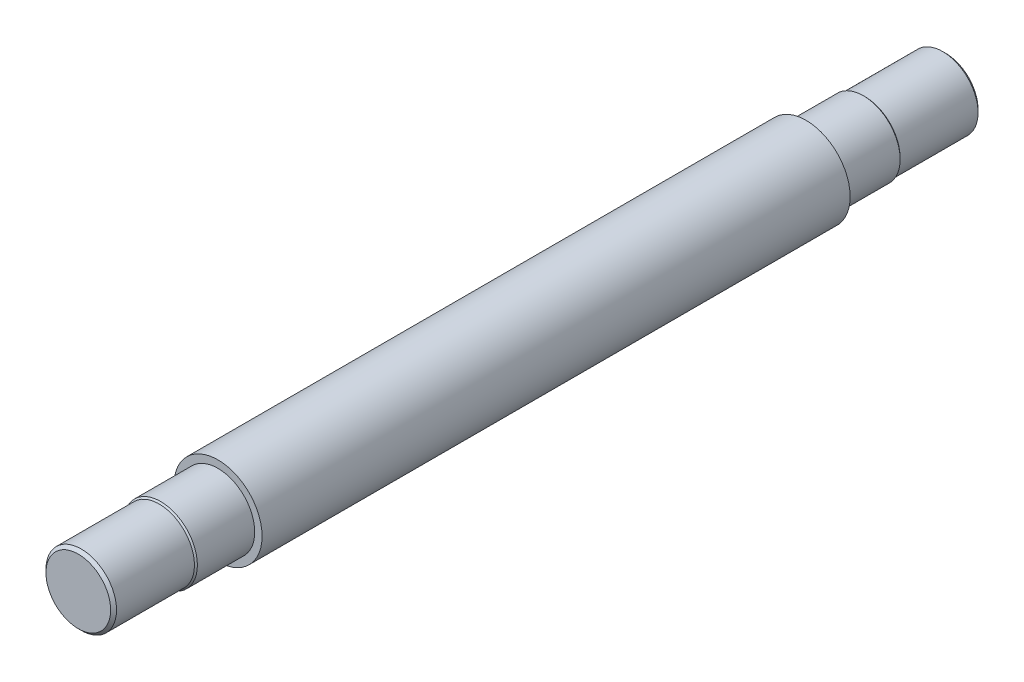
SolidWorks part; units mm, degrees
ref_plane "前视基准面" through (0, 0, 0) normal (0, 0, 1) x (1, 0, 0)
ref_plane "上视基准面" through (0, 0, 0) normal (0, 1, 0) x (1, 0, 0)
ref_plane "右视基准面" through (0, 0, 0) normal (1, 0, 0) x (0, 0, -1)
sketch "草图1" plane through (0, 0, 0) normal (0, 0, 1) x (1, 0, 0)
  circle A0 centre (0, 0) radius 30
extrude "凸台-拉伸1" add sketch "草图1" along normal blind 400
sketch "草图2" plane through (0, 0, 400) normal (0, 0, 1) x (1, 0, 0)
  circle A0 centre (0, 0) radius 25
extrude "凸台-拉伸2" add sketch "草图2" along normal blind 40
sketch "草图3" plane through (0, 0, 0) normal (0, 0, -1) x (-1, 0, 0)
  circle A0 centre (0, 0) radius 25
extrude "凸台-拉伸3" add sketch "草图3" along normal blind 40
sketch "草图4" plane through (0, 0, -40) normal (0, 0, -1) x (-1, 0, 0)
  circle A0 centre (0, 0) radius 24
extrude "凸台-拉伸4" add sketch "草图4" along normal blind 55
sketch "草图5" plane through (0, 0, 440) normal (0, 0, 1) x (1, 0, 0)
  circle A0 centre (0, 0) radius 24
extrude "凸台-拉伸5" add sketch "草图5" along normal blind 55
chamfer "倒角1" distance 1 angle 45 2 edges at (-25, 0, -40) (25, 0, 440)
chamfer "倒角2" distance 2 angle 45 2 edges at (24, 0, 495) (-24, 0, -95)
